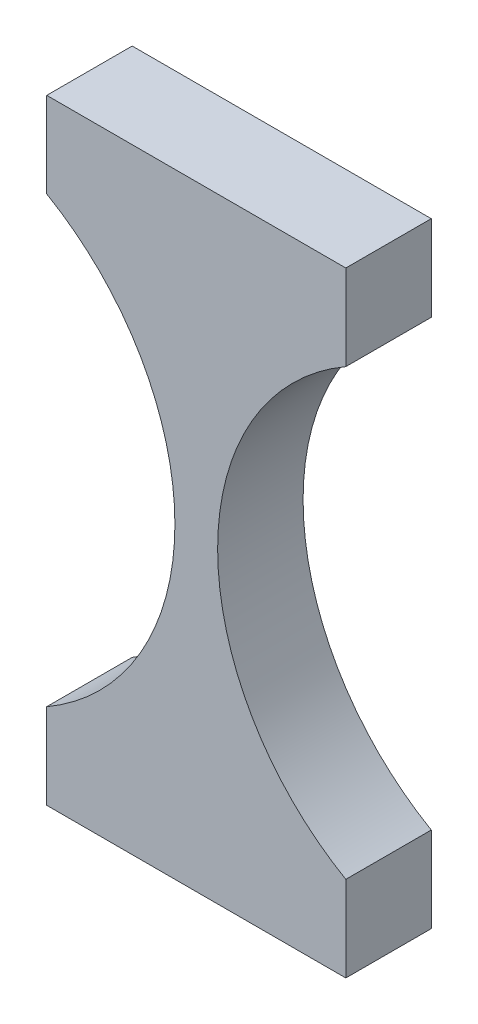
SolidWorks part; units mm, degrees
ref_plane "Front Plane" through (0, 0, 0) normal (0, 0, 1) x (1, 0, 0)
ref_plane "Top Plane" through (0, 0, 0) normal (0, 1, 0) x (1, 0, 0)
ref_plane "Right Plane" through (0, 0, 0) normal (1, 0, 0) x (0, 0, -1)
sketch "Sketch1" plane through (0, 0, 0) normal (0, 0, 1) x (1, 0, 0)
  line L0 (0, 0) -> (70.397, 0) construction
  line L1 (0, 0) -> (0, 104.5216) construction
  line L2 (-1.75, 3.5981) -> (1.75, 3.5981)
  line L3 (1.75, 3.5981) -> (1.75, 2.5981)
  line L4 (1.75, -2.5981) -> (1.75, -3.5981)
  line L12 (-1.75, -3.5981) -> (1.75, -3.5981)
  line L13 (0, -55) -> (0, 55) construction
  line L14 (-1.75, -2.5981) -> (-1.75, -3.5981)
  line L15 (-1.75, 3.5981) -> (-1.75, 2.5981)
  arc A0 (1.75, 2.5981) -> (1.75, -2.5981) centre (3.25, 0) ccw
  arc A2 (-1.75, 2.5981) -> (-1.75, -2.5981) centre (-3.25, 0) cw
  point P14 (0, -3.5981)
  point P18 (0, 3.5981)
  dimension "D2" = 6
  dimension "D1" = 3.25
  dimension "D3" = 1
  dimension "D4" = 1
  dimension "D9" = 1.75
extrude "Boss-Extrude1" add sketch "Sketch1" along normal blind 1
